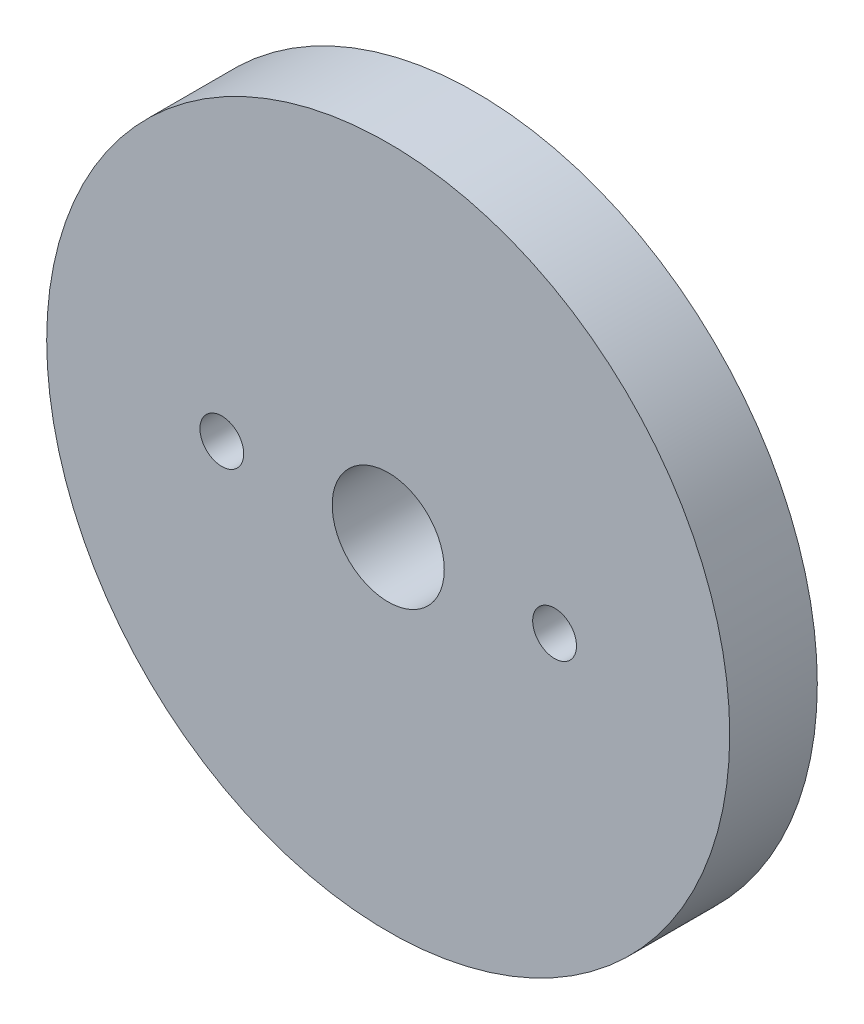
SolidWorks part; units mm, degrees
ref_plane "Face" through (0, 0, 0) normal (0, 0, 1) x (1, 0, 0)
ref_plane "Dessus" through (0, 0, 0) normal (0, 1, 0) x (1, 0, 0)
ref_plane "Droite" through (0, 0, 0) normal (1, 0, 0) x (0, 0, -1)
ref_plane "Plan4" through (0, 0, -5) normal (0, 0, -1) x (-1, 0, 0)
sketch "Esquisse1" plane through (0, 0, -5) normal (0, 0, -1) x (-1, 0, 0)
  circle A0 centre (-9.5, 0) radius 1.25
  circle A1 centre (9.5, 0) radius 1.25
  circle A2 centre (0, 0) radius 3.2
  circle A3 centre (0, 0) radius 19.5
extrude "Base-Extrusion" add sketch "Esquisse1" against normal blind 5
